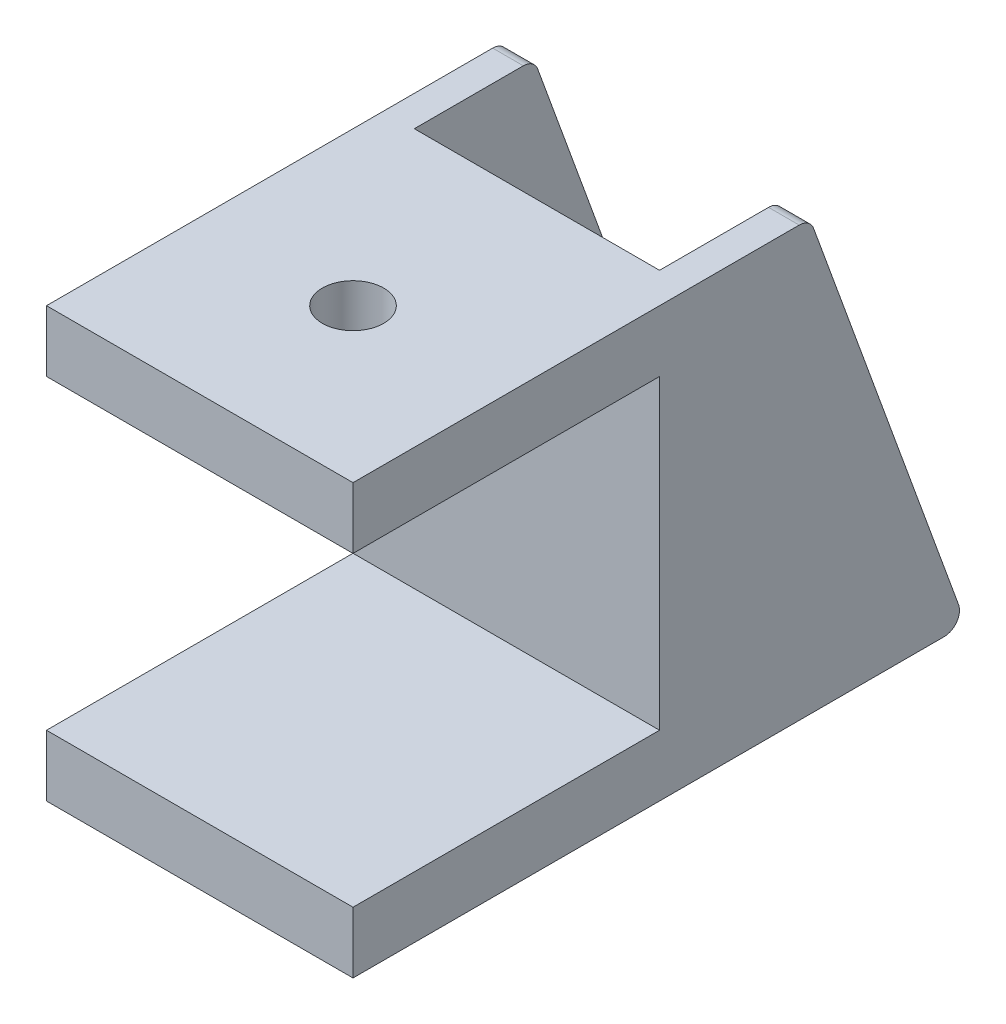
SolidWorks part; units mm, degrees
ref_plane "Alzado" through (0, 0, 0) normal (0, 0, 1) x (1, 0, 0)
ref_plane "Planta" through (0, 0, 0) normal (0, 1, 0) x (1, 0, 0)
ref_plane "Vista lateral" through (0, 0, 0) normal (1, 0, 0) x (0, 0, -1)
sketch "Sketch7" plane through (0, 0, 0) normal (1, 0, 0) x (0, 0, -1)
  line L0 (-29.8125, 23.99) -> (-29.8125, 19.99)
  line L1 (-29.8125, 19.99) -> (-9.8125, 19.99)
  line L2 (-9.8125, 19.99) -> (-9.8125, 0)
  line L3 (-9.8125, 0) -> (-29.8125, 0)
  line L4 (-29.8125, 0) -> (-29.8125, -4)
  line L5 (-29.8125, -4) -> (10.1875, -4)
  line L6 (10.1875, -4) -> (0, 23.99)
  line L7 (0, 23.99) -> (-29.8125, 23.99)
  line L8 (0, 0) -> (87.8092, 0) construction
  line L10 (0, -46.3065) -> (0, 45.8278) construction
  line L11 (-39.8125, -4) -> (-39.8125, 23.99) construction
  line L12 (-39.8125, 23.99) -> (-29.8125, 23.99) construction
  line L13 (-29.8125, -4) -> (-39.8125, -4) construction
  line L14 (-29.8125, 0) -> (-29.8125, 19.99) construction
  dimension "D1" = 4
  dimension "D2" = 19.99
  dimension "D3" = 4
  dimension "D4" = 20
  dimension "D5" = 70
  dimension "D6" = 20
  dimension "D7" = 10
extrude "Boss-Extrude3" add sketch "Sketch7" along normal blind 20
sketch "Sketch13" plane through (0, 23.99, 0) normal (0, 1, 0) x (1, 0, 0)
  line L0 (10, 0) -> (10, -29.8125) construction
  line L1 (20, 0) -> (0, 0) construction
  line L2 (20, -29.8125) -> (0, -29.8125) construction
  line L4 (20, 0) -> (20, -29.8125) construction
  line L6 (0, 0) -> (0, -29.8125) construction
  line L7 (0, -9.8125) -> (20, -9.8125) construction
  line L8 (0, -19.8125) -> (20, -19.8125) construction
  circle A0 centre (10, -19.8125) radius 2
  dimension "D3" = 4
  dimension "D1" = 20
  dimension "D2" = 10
extrude "Cut-Extrude4" cut sketch "Sketch13" against normal blind 5
sketch "Sketch16" plane through (0, 23.99, 0) normal (0, 1, 0) x (1, 0, 0)
  line L0 (2, 10.1875) -> (2, -7.8125)
  line L1 (20, 10.1875) -> (0, 10.1875) construction
  line L2 (2, -7.8125) -> (18, -7.8125)
  line L3 (18, -7.8125) -> (18, 10.1875)
  line L5 (0, 10.1875) -> (0, 0) construction
  line L6 (20, -29.8125) -> (0, -29.8125) construction
  line L8 (2, 10.1875) -> (2, 13.1875)
  line L9 (2, 13.1875) -> (18, 13.1875)
  line L10 (18, 13.1875) -> (18, 10.1875)
  dimension "D1" = 16
  dimension "D2" = 2
  dimension "D3" = 22
  dimension "D4" = 3
extrude "Cut-Extrude5" cut sketch "Sketch16" against normal blind 20
fillet "Fillet1" radius 1 2 edges at (19, 23.99, 0) (1, 23.99, 0)
sketch "Sketch17" plane through (0, 3.99, 0) normal (0, 1, 0) x (1, 0, 0)
  line L0 (10, -29.8125) -> (10, 10.1875) construction
  line L1 (20, -29.8125) -> (0, -29.8125) construction
  line L2 (20, 10.1875) -> (0, 10.1875) construction
  line L3 (10, 2.7275) -> (10, -3.2725) construction
  line L4 (14.1, 2.7275) -> (14.1, -3.2725)
  line L5 (5.9, 2.7275) -> (5.9, -3.2725)
  line L7 (2, -7.8125) -> (18, -7.8125) construction
  line L8 (2, 7.2794) -> (18, 7.2794) construction
  arc A0 (14.1, 2.7275) -> (5.9, 2.7275) centre (10, 2.7275) ccw
  arc A1 (5.9, -3.2725) -> (14.1, -3.2725) centre (10, -3.2725) ccw
  point P8 (10, -0.2725)
  dimension "D3" = 4.54
  dimension "D1" = 8.2
  dimension "D2" = 6
  dimension "D4" = 4.5519
extrude "Cut-Extrude6" cut sketch "Sketch17" against normal blind 20
fillet "Fillet2" radius 1 1 edges at (10, -4, -10.1875)
